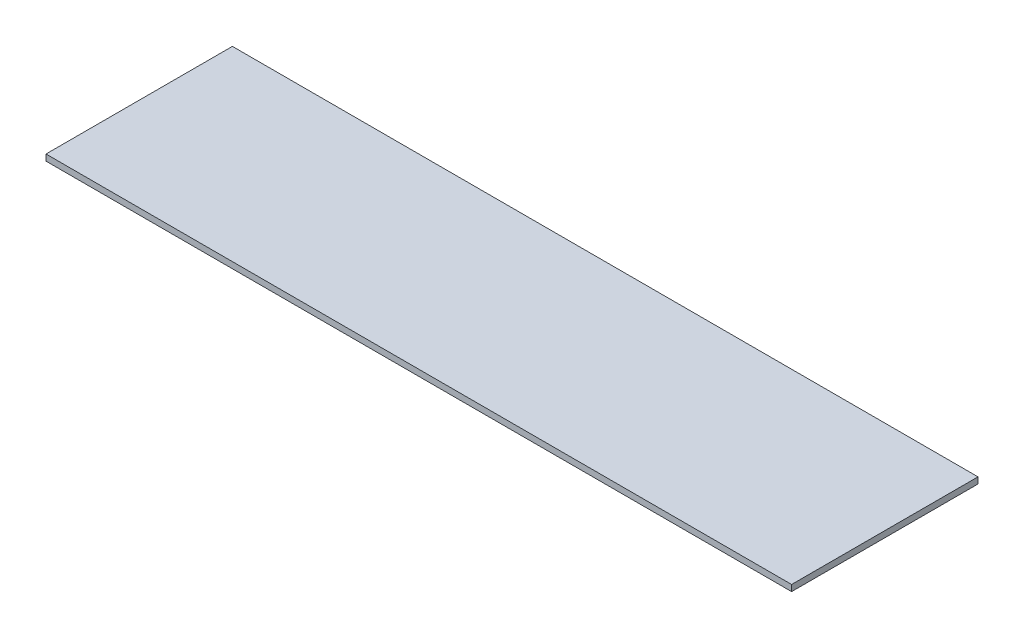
SolidWorks part; units mm, degrees
ref_plane "Plan de face" through (0, 0, 0) normal (0, 0, 1) x (1, 0, 0)
ref_plane "Plan de dessus" through (0, 0, 0) normal (0, 1, 0) x (1, 0, 0)
ref_plane "Plan de droite" through (0, 0, 0) normal (1, 0, 0) x (0, 0, -1)
sketch "Esquisse2" plane through (0, 0, 0) normal (0, 1, 0) x (1, 0, 0)
  line L1 (-60, -15) -> (60, -15)
  line L2 (-60, -15) -> (-60, 15)
  line L3 (-60, 15) -> (60, 15)
  line L4 (60, -15) -> (60, 15)
  line L5 (-60, -15) -> (60, 15) construction
  line L6 (-60, 15) -> (60, -15) construction
  point P0 (0, 0)
  dimension "D1" = 30
  dimension "D2" = 120
extrude "Boss.-Extru.1" add sketch "Esquisse2" along normal blind 1 contours L3 L4 L1 L2
sketch "Cavités" plane through (0, 0, 0) normal (0, 1, 0) x (1, 0, 0)
  line L0 (-60, -15) -> (60, -15) construction
  line L1 (-63, 15) -> (-33, 15) construction
  line L2 (-63, 15) -> (-63, -15) construction
  line L3 (-63, -15) -> (-33, -15) construction
  line L4 (-33, 15) -> (-33, -15) construction
  line L5 (-60, 15) -> (60, 15) construction
  line L6 (-31, 15) -> (-1, 15) construction
  line L7 (-31, 15) -> (-31, -15) construction
  line L8 (-31, -15) -> (-1, -15) construction
  line L9 (-1, 15) -> (-1, -15) construction
  line L10 (-33, 15) -> (-31, 15) construction
  line L11 (1, 15) -> (31, 15) construction
  line L12 (1, 15) -> (1, -15) construction
  line L13 (1, -15) -> (31, -15) construction
  line L14 (31, 15) -> (31, -15) construction
  line L15 (33, 15) -> (63, 15) construction
  line L16 (33, 15) -> (33, -15) construction
  line L17 (33, -15) -> (63, -15) construction
  line L18 (63, 15) -> (63, -15) construction
  line L19 (-1, 15) -> (1, 15) construction
  line L20 (31, 15) -> (33, 15) construction
  line L21 (-60, 15) -> (-63, 15) construction
  line L22 (63, 15) -> (60, 15) construction
  dimension "D1" = 30
  dimension "D2" = 2
